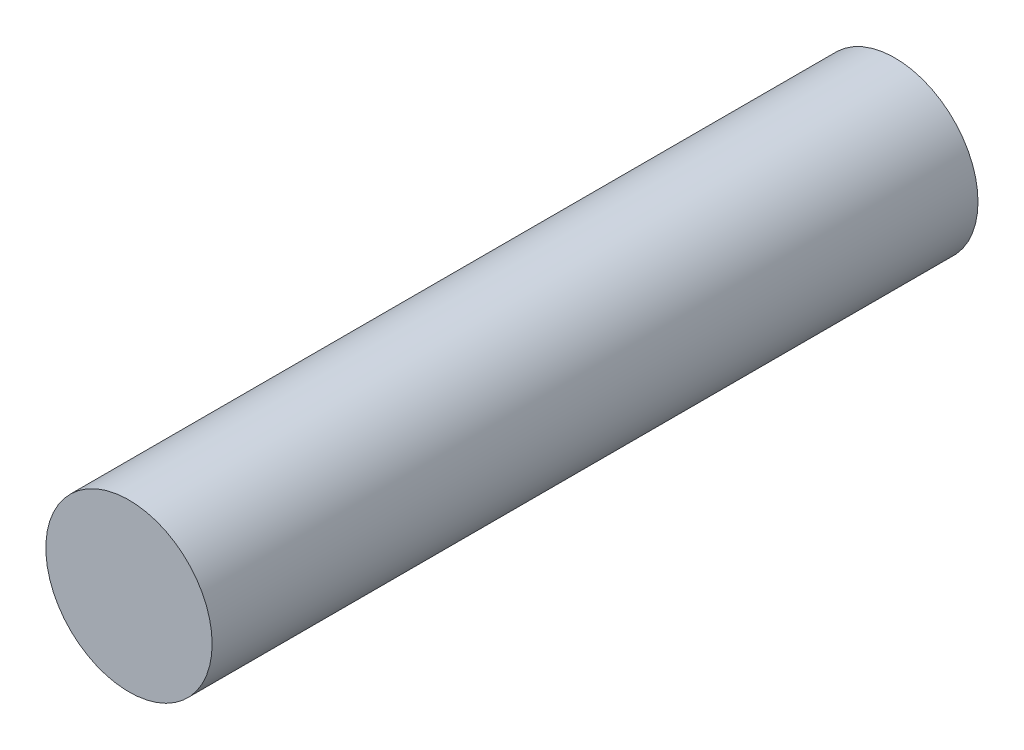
SolidWorks part; units mm, degrees
ref_plane "Front Plane" through (0, 0, 0) normal (0, 0, 1) x (1, 0, 0)
ref_plane "Top Plane" through (0, 0, 0) normal (0, 1, 0) x (1, 0, 0)
ref_plane "Right Plane" through (0, 0, 0) normal (1, 0, 0) x (0, 0, -1)
sketch "Sketch1" plane through (0, 0, 0) normal (0, 0, 1) x (1, 0, 0)
  circle A0 centre (0, 0) radius 38
  dimension "D1" = 76
extrude "Boss-Extrude1" add sketch "Sketch1" along normal mid plane 350
